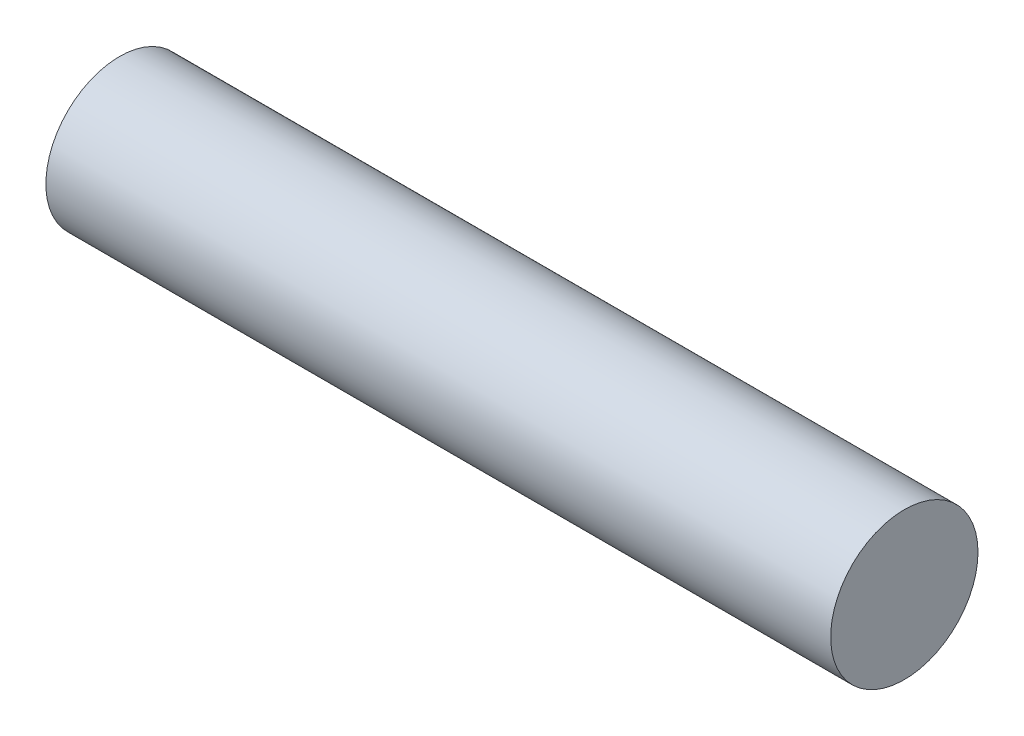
SolidWorks part; units mm, degrees
ref_plane "Ebene vorne" through (0, 0, 0) normal (0, 0, 1) x (1, 0, 0)
ref_plane "Ebene oben" through (0, 0, 0) normal (0, 1, 0) x (1, 0, 0)
ref_plane "Ebene rechts" through (0, 0, 0) normal (1, 0, 0) x (0, 0, -1)
sketch "Skizze1" plane through (0, 0, 0) normal (0, 0, 1) x (1, 0, 0)
  line L1 (0, 0) -> (-159.7961, 0)
  line L2 (0, 0) -> (0, 15)
  line L3 (0, 15) -> (-159.7961, 15)
  line L4 (-159.7961, 0) -> (-159.7961, 15)
  dimension "D1" = 15
revolve "Rotation1" add sketch "Skizze1" angle 360 about L1
equation "\"LÄNGE\"=0"
equation "\"BREITE\"=0"
equation "\"HÖHE\"=0"
equation "\"DURCHMESSER\"=0"
equation "\"Stückzahl\"= 1"
